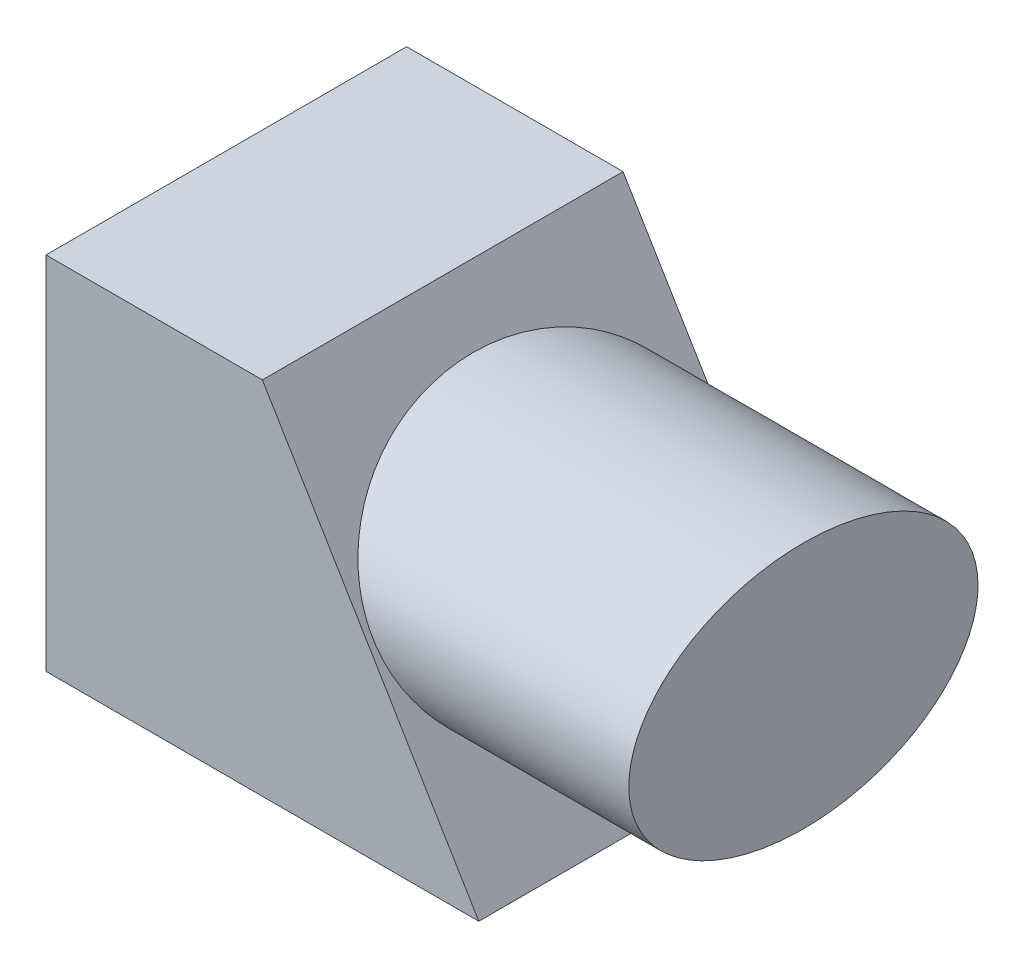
SolidWorks part; units mm, degrees
ref_plane "Front" through (0, 0, 0) normal (0, 0, 1) x (1, 0, 0)
ref_plane "Top" through (0, 0, 0) normal (0, 1, 0) x (1, 0, 0)
ref_plane "Right" through (0, 0, 0) normal (1, 0, 0) x (0, 0, -1)
sketch "Sketch2" plane through (0, 0, 0) normal (0, 0, 1) x (1, 0, 0)
  line L0 (0, 0) -> (60, 0)
  line L1 (60, 0) -> (30, 50)
  line L2 (30, 50) -> (0, 50)
  line L3 (0, 50) -> (0, 0)
  dimension "D1" = 50
  dimension "D2" = 60
  dimension "D3" = 30
extrude "Extrude2" add sketch "Sketch2" along normal mid plane 50
ref_plane "Plane1" through (80, 0, 0) normal (1, 0, 0) x (0, 0, -1)
sketch "Sketch4" plane through (80, 0, 0) normal (1, 0, 0) x (0, 0, -1)
  ellipse E0 centre (0, 25.7579) end of major axis (24.2033, 25.7579) minor radius 17.1677
extrude "Extrude3" add sketch "Sketch4" against normal up to surface (35.4548 mm away)
